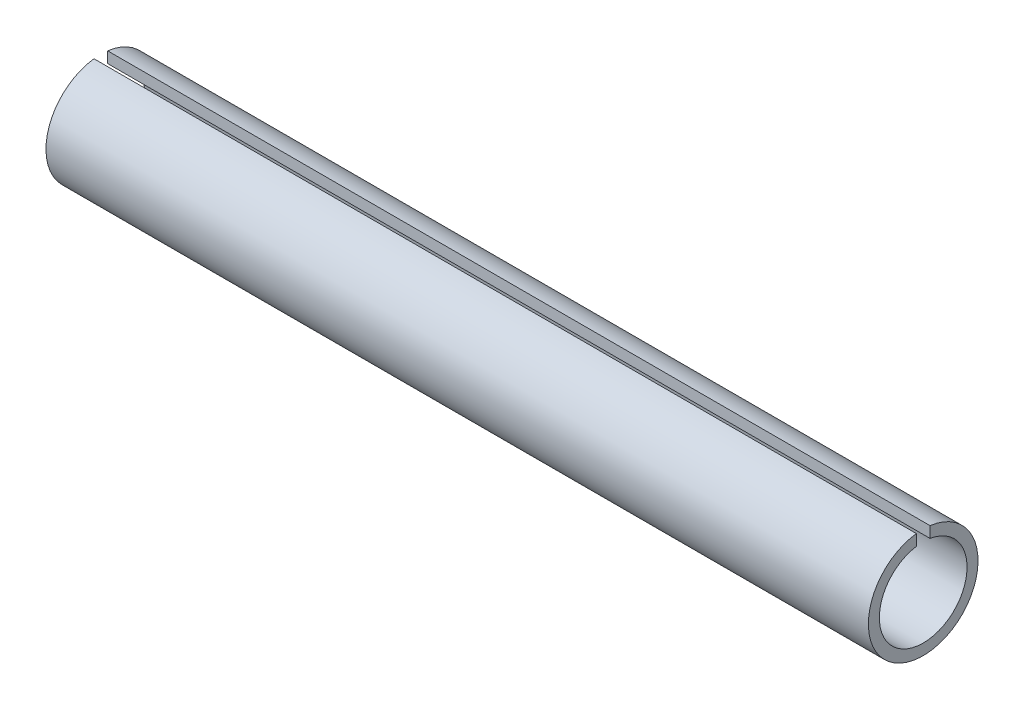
SolidWorks part; units mm, degrees
ref_plane "Face" through (0, 0, 0) normal (0, 0, 1) x (1, 0, 0)
ref_plane "Dessus" through (0, 0, 0) normal (0, 1, 0) x (1, 0, 0)
ref_plane "Droite" through (0, 0, 0) normal (1, 0, 0) x (0, 0, -1)
sketch "Esquisse1" plane through (0, 0, 0) normal (1, 0, 0) x (0, 0, -1)
  circle A0 centre (0, 0) radius 1
extrude "Base-Extrusion" add sketch "Esquisse1" along normal blind 15
sketch "Esquisse2" plane through (15, 0, 0) normal (1, 0, 0) x (0, 0, -1)
  circle A0 centre (0, 0) radius 0.8
extrude "Enlèv. mat.-Extru.1" cut sketch "Esquisse2" against normal through all
sketch "Esquisse3" plane through (15, 0, 0) normal (1, 0, 0) x (0, 0, -1)
  line L1 (-0.125, 1.1551) -> (0.125, 1.1551)
  line L2 (-0.125, 1.1551) -> (-0.125, 0.515)
  line L3 (-0.125, 0.515) -> (0.125, 0.515)
  line L4 (0.125, 1.1551) -> (0.125, 0.515)
  dimension "D1" = 0.25
  dimension "D2" = 0.125
extrude "Enlèv. mat.-Extru.2" cut sketch "Esquisse3" against normal through all
